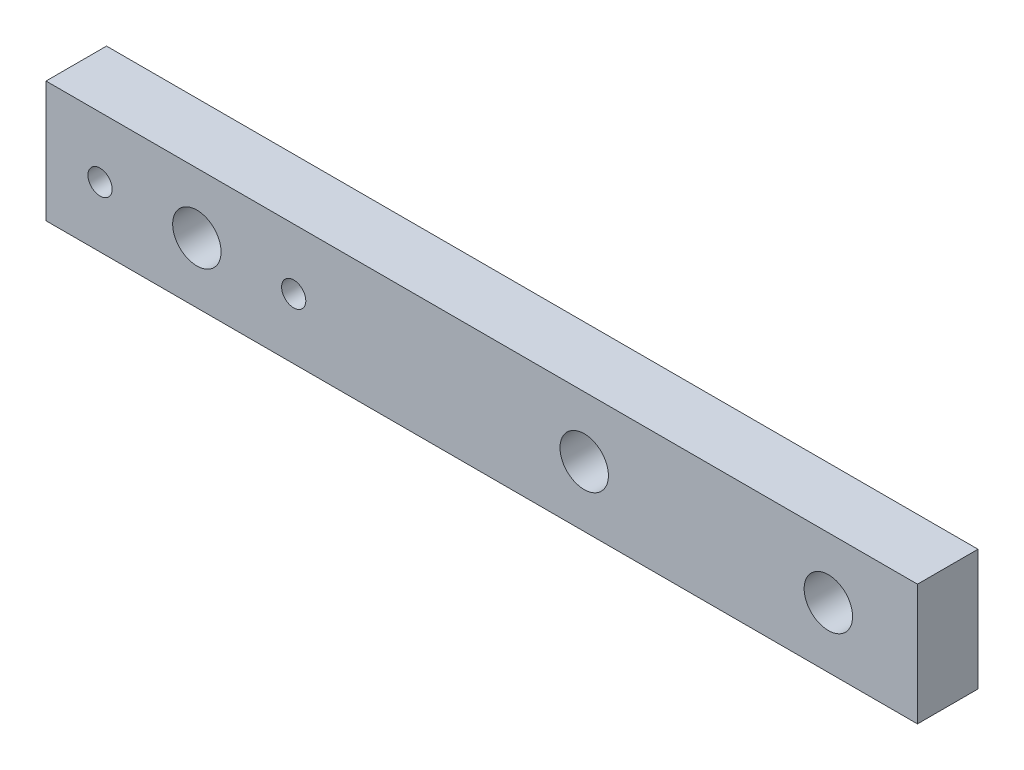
SolidWorks part; units mm, degrees
ref_plane "Front Plane" through (0, 0, 0) normal (0, 0, 1) x (1, 0, 0)
ref_plane "Top Plane" through (0, 0, 0) normal (0, 1, 0) x (1, 0, 0)
ref_plane "Right Plane" through (0, 0, 0) normal (1, 0, 0) x (0, 0, -1)
sketch "Sketch1" plane through (0, 0, 0) normal (0, 0, 1) x (1, 0, 0)
  line L1 (-37, 5) -> (35, 5)
  line L2 (-37, 5) -> (-37, -5)
  line L3 (-37, -5) -> (35, -5)
  line L4 (35, 5) -> (35, -5)
extrude "Boss-Extrude1" add sketch "Sketch1" along normal blind 5
sketch "Sketch2" plane through (0, 0, 5) normal (0, 0, 1) x (1, 0, 0)
  circle A0 centre (-32.5355, 0) radius 1
  circle A1 centre (-24.5355, 0) radius 2
  circle A2 centre (-16.5355, 0) radius 1
  circle A3 centre (7.4645, 0) radius 2
  circle A4 centre (27.638, 0) radius 2
  dimension "D1" = 8
  dimension "D2" = 8
  dimension "D3" = 32
  dimension "D4" = 20.1734
extrude "Cut-Extrude1" cut sketch "Sketch2" against normal blind 5
sketch "Sketch3" plane through (0, 0, 5) normal (0, 0, 1) x (1, 0, 0)
  line L0 (-37, 0) -> (35, 0)
  line L1 (-37, 5) -> (-37, -5) construction
  line L2 (35, -5) -> (35, 5) construction
